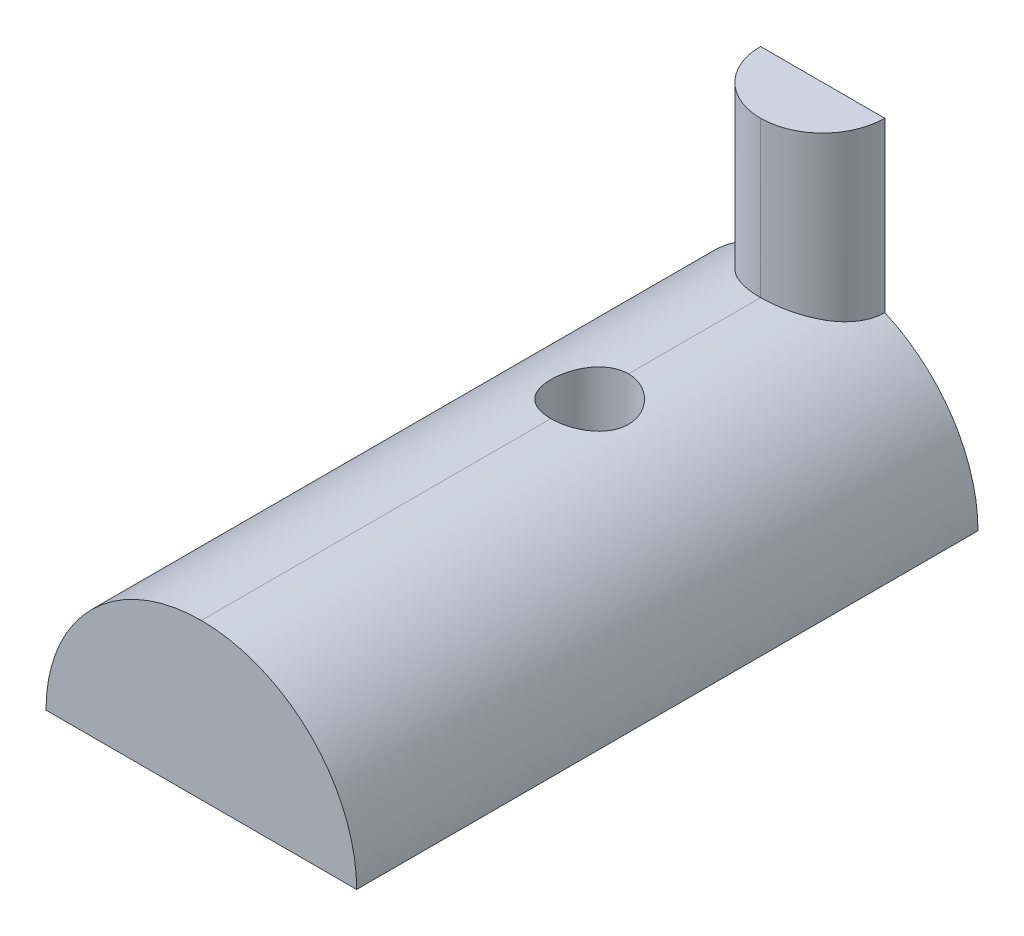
SolidWorks part; units mm, degrees
ref_plane "Front Plane" through (0, 0, 0) normal (0, 0, 1) x (1, 0, 0)
ref_plane "Top Plane" through (0, 0, 0) normal (0, 1, 0) x (1, 0, 0)
ref_plane "Right Plane" through (0, 0, 0) normal (1, 0, 0) x (0, 0, -1)
sketch "Sketch1" plane through (0, 0, 0) normal (0, 0, 1) x (1, 0, 0)
  line L0 (-1270, 0) -> (1270, 0)
  arc A0 (1270, 0) -> (-1270, 0) centre (0, 0) ccw
  dimension "D1" = 2540
extrude "Boss-Extrude1" add sketch "Sketch1" along normal blind 5080
sketch "Sketch2" plane through (0, 0, 0) normal (0, -1, 0) x (1, 0, 0)
  line L0 (-1270, 0) -> (1270, 0) construction
  line L1 (508, 0) -> (-508, 0)
  arc A0 (508, 0) -> (-508, 0) centre (0, 0) ccw
  dimension "D1" = 508
extrude "Boss-Extrude2" add sketch "Sketch2" against normal blind 2540
sketch "Sketch3" plane through (0, 0, 0) normal (0, -1, 0) x (1, 0, 0)
  line L0 (-1270, 0) -> (1270, 0) construction
  line L1 (-1270, 5080) -> (-1270, 0) construction
  circle A0 centre (0, 1905) radius 317.5
  dimension "D3" = 635
  dimension "D1" = 1905
  dimension "D2" = 1270
extrude "Cut-Extrude1" cut sketch "Sketch3" against normal through all
ref_point "Point1" [suppressed] parameters "D1"=1196.9468
ref_point "Point2" [suppressed] parameters "D1"=2792.8759
ref_plane "Plane2" [suppressed] through (523.5127, 0, 0) normal (1, 0, 0) x (0, 0, -1)
ref_plane "Plane3" [suppressed] through (2016.4873, 0, 0) normal (1, 0, 0) x (0, 0, -1)
ref_point "Point3" [suppressed]
ref_point "Point4" [suppressed] parameters "D1"=478.7787
ref_plane "Plane4" [suppressed] through (971.4051, 0, 0) normal (1, 0, 0) x (0, 0, -1)
ref_plane "Plane5" [suppressed] through (1568.5949, 0, 0) normal (1, 0, 0) x (0, 0, -1)
